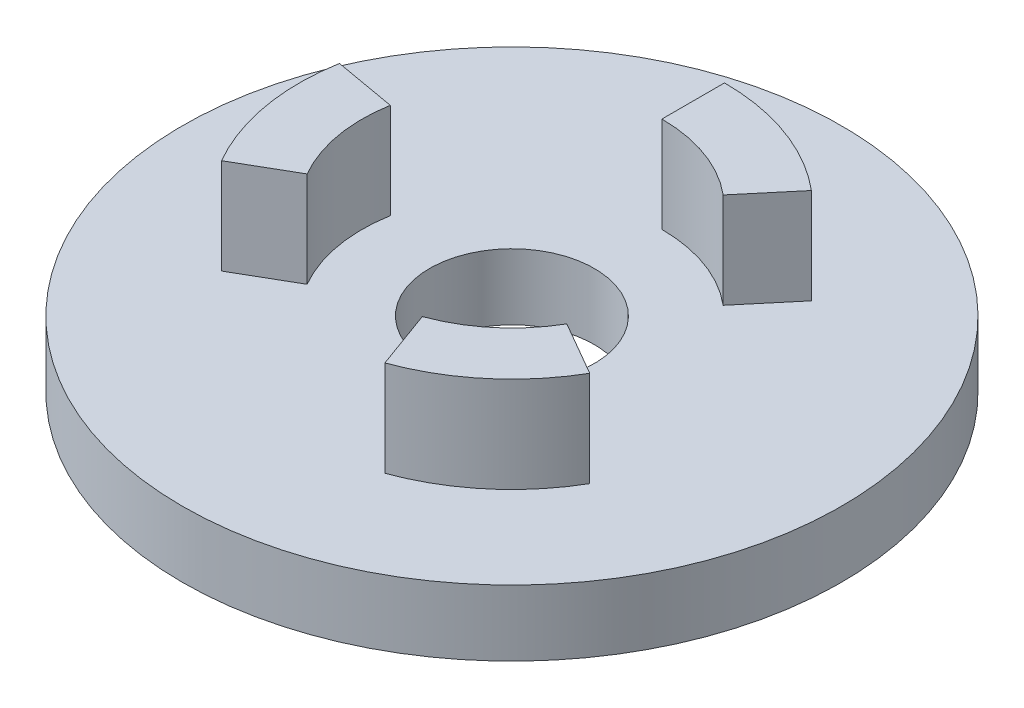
SolidWorks part; units mm, degrees
ref_plane "前视基准面" through (0, 0, 0) normal (0, 0, 1) x (1, 0, 0)
ref_plane "上视基准面" through (0, 0, 0) normal (0, 1, 0) x (1, 0, 0)
ref_plane "右视基准面" through (0, 0, 0) normal (1, 0, 0) x (0, 0, -1)
sketch "草图1" plane through (0, 0, 0) normal (0, 1, 0) x (1, 0, 0)
  circle A0 centre (0, 0) radius 10
  dimension "D1" = 20
extrude "凸台-拉伸1" add sketch "草图1" along normal blind 2
sketch "草图2" plane through (0, 2, 0) normal (0, 1, 0) x (1, 0, 0)
  line L0 (0, 4.55) -> (0, 6.45)
  line L1 (2.9247, 3.4855) -> (4.146, 4.941)
  circle A0 centre (0, 0) radius 5.5 construction
  circle A1 centre (0, 0) radius 4.55
  circle A2 centre (0, 0) radius 6.45
  dimension "D1" = 11
  dimension "D2" = 9.1
  dimension "D3" = 12.9
  dimension "D4" = 40
extrude "凸台-拉伸2" add sketch "草图2" along normal blind 2.9 contours L1 A2 L0 A1
pattern_circular "阵列(圆周)1" count 3 every 120 about axis through (0, 0, 0) along (0, 1, 0) of "凸台-拉伸2"
sketch "草图3" plane through (0, 2, 0) normal (0, 1, 0) x (1, 0, 0)
  circle A0 centre (0, 0) radius 2.5
  dimension "D1" = 5
extrude "切除-拉伸1" cut sketch "草图3" against normal through all
